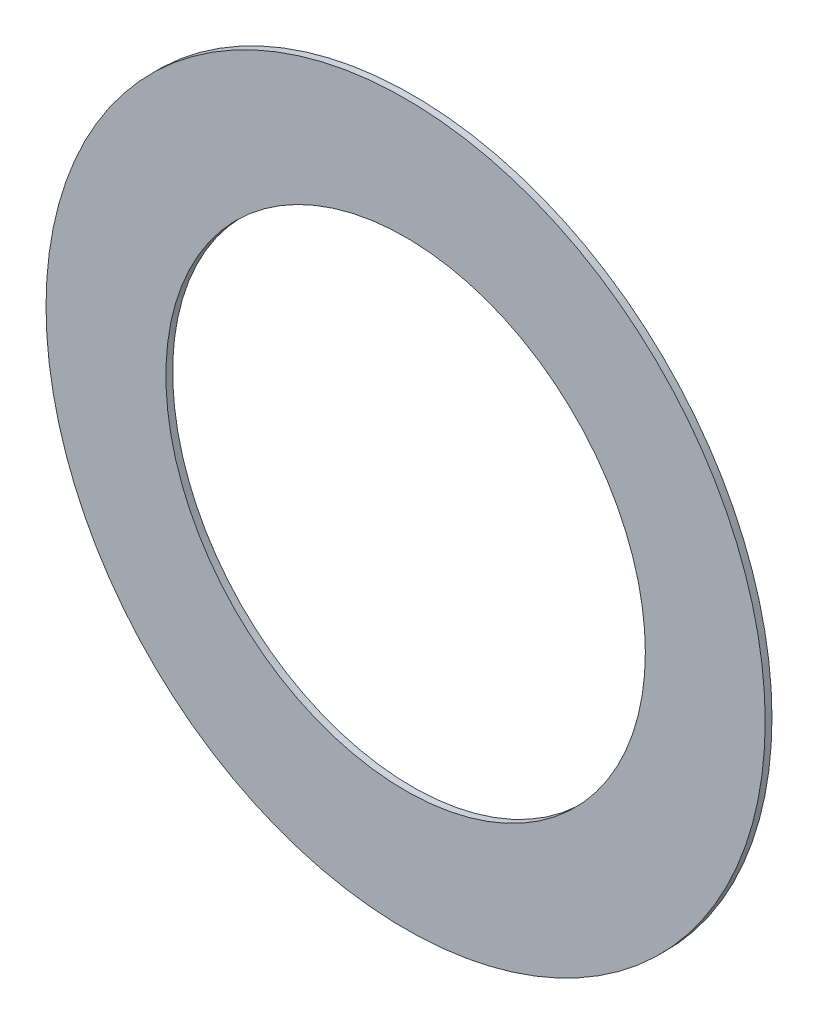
SolidWorks part; units mm, degrees
ref_plane "Front Plane" through (0, 0, 0) normal (0, 0, 1) x (1, 0, 0)
ref_plane "Top Plane" through (0, 0, 0) normal (0, 1, 0) x (1, 0, 0)
ref_plane "Right Plane" through (0, 0, 0) normal (1, 0, 0) x (0, 0, -1)
sketch "Sketch1" plane through (0, 0, 0) normal (0, 0, 1) x (1, 0, 0)
  circle A278 centre (0, 0) radius 4.5
  circle A279 centre (0, 0) radius 6.75
extrude "Boss-Extrude1" add sketch "Sketch1" along normal blind 0.127
